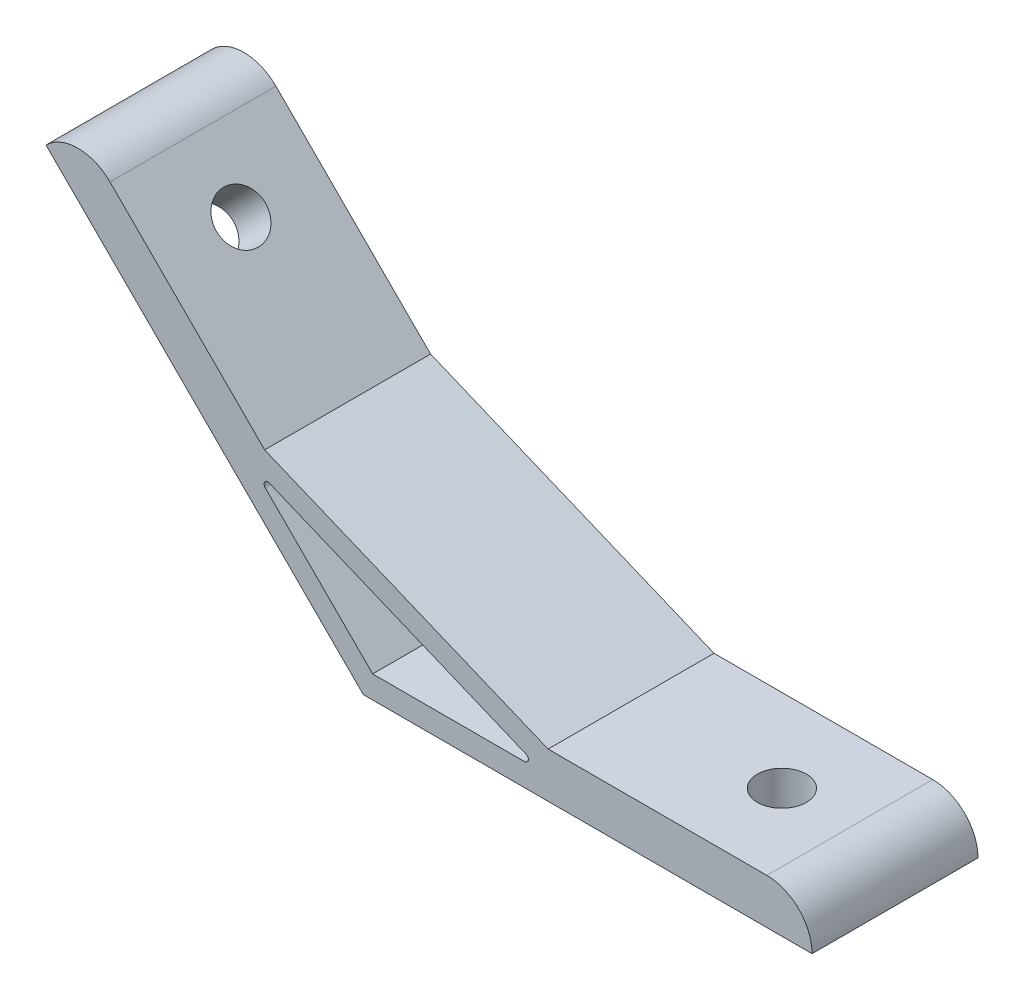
SolidWorks part; units mm, degrees
ref_plane "前视基准面" through (0, 0, 0) normal (0, 0, 1) x (1, 0, 0)
ref_plane "上视基准面" through (0, 0, 0) normal (0, 1, 0) x (1, 0, 0)
ref_plane "右视基准面" through (0, 0, 0) normal (1, 0, 0) x (0, 0, -1)
sketch "草图1" plane through (0, 0, 0) normal (0, 0, 1) x (1, 0, 0)
  line L0 (0, 0) -> (59.5, 0)
  line L1 (59.5, 0) -> (59.5, 6)
  line L2 (59.5, 6) -> (24.5, 6)
  line L3 (-42.0729, 42.0729) -> (-37.8302, 46.3155)
  line L4 (0, 0) -> (-42.0729, 42.0729)
  line L5 (-37.8302, 46.3155) -> (-13.0815, 21.5668)
  line L6 (-13.0815, 21.5668) -> (24.5, 6)
  dimension "D1" = 6
  dimension "D2" = 6
  dimension "D3" = 59.5
  dimension "D4" = 59.5
  dimension "D6" = 35
  dimension "D7" = 135
  dimension "D9" = 35
extrude "凸台-拉伸1" add sketch "草图1" along normal mid plane 22
sketch "草图2" plane through (0, 0, 11) normal (0, 0, 1) x (1, 0, 0)
  line L0 (-14.7808, 19.0235) -> (23.9033, 3)
  line L1 (-14.7808, 19.0235) -> (1.2426, 3)
  line L2 (1.2426, 3) -> (23.9033, 3)
  line L3 (0, 0) -> (59.5, 0) construction
  line L4 (-42.0729, 42.0729) -> (0, 0) construction
  line L6 (24.5, 6) -> (-13.0815, 21.5668) construction
  dimension "D1" = 3
  dimension "D2" = 3
  dimension "D3" = 22.5
  dimension "D4" = 22.5
  dimension "D5" = 3
extrude "切除-拉伸1" cut sketch "草图2" against normal through all
fillet "圆角1" radius 0.5 1 edges at (-14.7808, 19.0235, 0)
sketch "草图4" plane through (0, 0, 0) normal (-0.7071, -0.7071, 0) x (0.7071, -0.7071, 0)
  line L0 (-59.5, 11) -> (-59.5, -11) construction
  line L2 (-59.5, 11) -> (0, 11) construction
  circle A0 centre (-44.5, 0) radius 3.25
  dimension "D2" = 11
  dimension "D3" = 6.5
  dimension "D1" = 15
extrude "切除-拉伸2" cut sketch "草图4" against normal blind 32
fillet "圆角2" radius 6 1 edges at (-37.8302, 46.3155, 0)
ref_plane "基准面1" through (0, 0, 0) normal (-0.9239, 0.3827, 0) x (0, 0, 1)
mirror "镜向4" about plane through (0, 0, 0) normal (-0.9239, 0.3827, 0) of "切除-拉伸2"
fillet "圆角3" radius 6 1 edges at (59.5, 6, 0)
fillet "圆角4" radius 0.5 1 edges at (23.9033, 3, 0)
